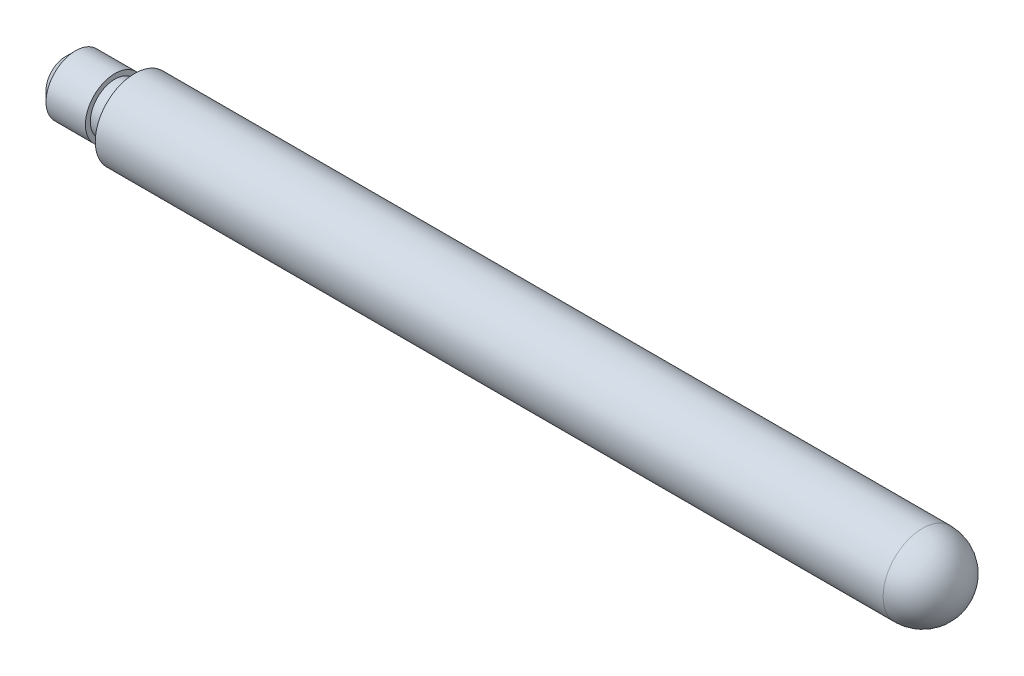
SolidWorks part; units mm, degrees
ref_plane "前视基准面" through (0, 0, 0) normal (0, 0, 1) x (1, 0, 0)
ref_plane "上视基准面" through (0, 0, 0) normal (0, 1, 0) x (1, 0, 0)
ref_plane "右视基准面" through (0, 0, 0) normal (1, 0, 0) x (0, 0, -1)
sketch "草图1" plane through (0, 0, 0) normal (0, 1, 0) x (1, 0, 0)
  line L0 (-71.611, 0) -> (65.2218, 0) construction
  line L1 (0, 53.5161) -> (0, -52.1354) construction
  line L2 (-47.5616, 0) -> (-47.5616, 3)
  line L3 (-47.5616, 3) -> (-42.5616, 3)
  line L4 (-42.5616, 3) -> (-42.5616, 2.5)
  line L5 (-42.5616, 2.5) -> (-40.5616, 2.5)
  line L6 (-40.5616, 2.5) -> (-40.5616, 4)
  line L7 (-40.5616, 4) -> (39.4384, 4)
  line L8 (-47.5616, 0) -> (43.4384, 0)
  arc A0 (39.4384, 4) -> (43.4384, 0) centre (39.4384, 0) cw
  dimension "D4" = 4
  dimension "D1" = 91
  dimension "D2" = 5
  dimension "D3" = 2
  dimension "D5" = 3
  dimension "D6" = 2.5
revolve "旋转1" add sketch "草图1" angle 360 about L8
chamfer "倒角2" distance 1 angle 45 1 edges at (-47.5616, 0, 3)
